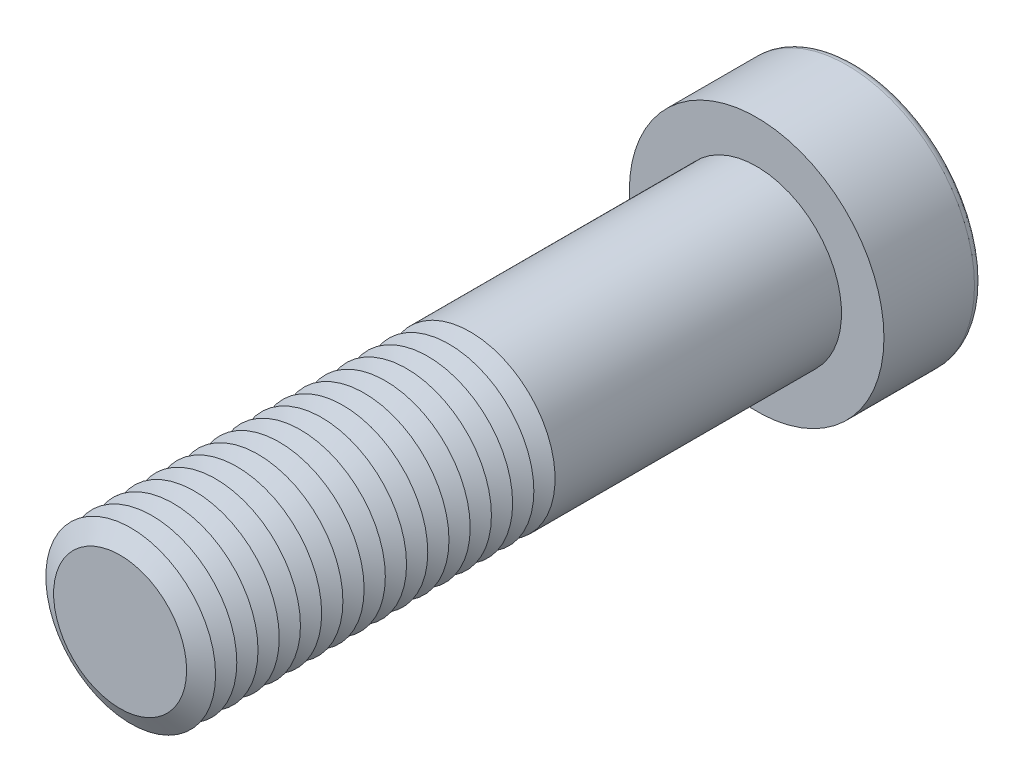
SolidWorks part; units mm, degrees
ref_plane "Front Plane" through (0, 0, 0) normal (0, 0, 1) x (1, 0, 0)
ref_plane "Top Plane" through (0, 0, 0) normal (0, 1, 0) x (1, 0, 0)
ref_plane "Right Plane" through (0, 0, 0) normal (1, 0, 0) x (0, 0, -1)
sketch "Sketch1" plane through (0, 0, 0) normal (0, 0, 1) x (1, 0, 0)
  circle A0 centre (0, 0) radius 12
  dimension "D1" = 24
extrude "Boss-Extrude1" add sketch "Sketch1" along normal blind 90
sketch "Sketch2" plane through (0, 0, 0) normal (0, 0, -1) x (-1, 0, 0)
  circle A0 centre (0, 0) radius 18
  dimension "D1" = 36
extrude "Boss-Extrude2" add sketch "Sketch2" along normal blind 14
sketch "Sketch3" plane through (0, 0, -14) normal (0, 0, -1) x (-1, 0, 0)
  line L1 (-5.4848, 9.5) -> (-10.9697, 0)
  line L2 (-10.9697, 0) -> (-5.4848, -9.5)
  line L3 (-5.4848, -9.5) -> (5.4848, -9.5)
  line L4 (5.4848, -9.5) -> (10.9697, 0)
  line L5 (10.9697, 0) -> (5.4848, 9.5)
  line L6 (5.4848, 9.5) -> (-5.4848, 9.5)
  circle A0 centre (0, 0) radius 9.5 construction
  dimension "D1" = 19
extrude "Cut-Extrude1" cut sketch "Sketch3" against normal blind 14.25
fillet "Fillet1" radius 1.2 1 edges at (-18, 0, -14)
sketch "Sketch4" plane through (0, 0, 0.25) normal (0, 0, -1) x (-1, 0, 0)
  line L0 (5.4848, -9.5) -> (10.9697, 0) construction
  circle A0 centre (0, 0) radius 9.5
extrude "Cut-Extrude2" cut sketch "Sketch4" against normal through all draft 60
sketch "Sketch5" plane through (0, 0, -14) normal (0, 0, -1) x (-1, 0, 0)
  circle A0 centre (0, 0) radius 10.9697
extrude "Cut-Extrude3" cut sketch "Sketch5" against normal through all draft 75
sketch "Sketch7" plane through (0, 0, 0) normal (1, 0, 0) x (0, 0, -1)
  line L25 (-90, 9.4019) -> (-88.5, 12)
  line L26 (-90, 12) -> (-90, -12) construction
  line L27 (-88.5, 12) -> (-91.5, 12)
  line L28 (-91.5, 12) -> (-90, 9.4019)
  line L29 (0, 12) -> (-90, 12) construction
  dimension "D1" = 3
revolve "Cut-Revolve1" cut sketch "Sketch7" angle 360 about axis through (0, 0, 90) along (0, 0, -1)
pattern_linear "LPattern1" count 17 spacing 3 along (0, 0, -1) of "Cut-Revolve1"
